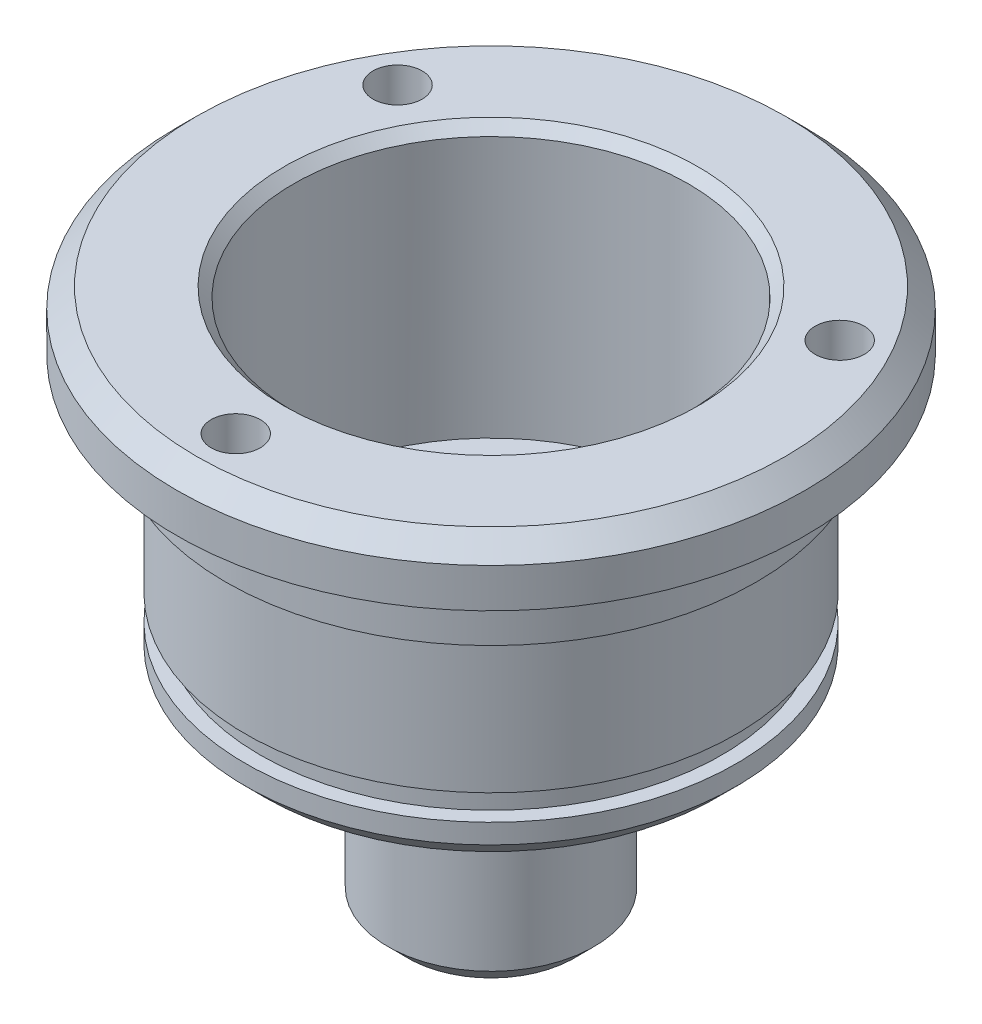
SolidWorks part; units mm, degrees
ref_plane "前视基准面" through (0, 0, 0) normal (0, 0, 1) x (1, 0, 0)
ref_plane "上视基准面" through (0, 0, 0) normal (0, 1, 0) x (1, 0, 0)
ref_plane "右视基准面" through (0, 0, 0) normal (1, 0, 0) x (0, 0, -1)
sketch "草图1" plane through (0, 0, 0) normal (0, 0, 1) x (1, 0, 0)
  line L0 (0, 0) -> (0, 17.0132) construction
  line L1 (12.5, 0) -> (10.05, 0)
  line L2 (12.5, 0) -> (12.5, 2)
  line L3 (12.5, 2) -> (11.75, 2)
  line L4 (11.75, 2) -> (11.75, 3.3)
  line L5 (11.75, 3.3) -> (12.5, 3.3)
  line L6 (12.5, 3.3) -> (12.5, 10.5)
  line L7 (12.5, 10.5) -> (13.5, 10.5)
  line L8 (16, 13.8) -> (16, 16.8)
  line L9 (16, 16.8) -> (10.05, 16.8)
  line L10 (10.05, 0) -> (10.05, 16.8)
  line L11 (13.5, 10.5) -> (13.5, 13.8)
  line L12 (13.5, 13.8) -> (16, 13.8)
  point P12 (12.5, 6.9)
  dimension "D1" = 7.2
  dimension "D2" = 23.5
  dimension "D3" = 25
  dimension "D4" = 1.3
  dimension "D5" = 20.1
  dimension "D6" = 2
  dimension "D7" = 27
  dimension "D8" = 10.5
  dimension "D9" = 32
  dimension "D10" = 3
revolve "旋转1" add sketch "草图1" angle 360 about L0
chamfer "倒角1" distance 1 angle 45 1 edges at (0, 0, -12.5)
chamfer "倒角2" distance 1 angle 45 1 edges at (0, 16.8, -16)
sketch "草图2" plane through (0, 13.8, 0) normal (0, -1, 0) x (-1, 0, 0)
  line L1 (-11.2583, 6.5) -> (0, -13) construction
  line L2 (0, -13) -> (11.2583, 6.5) construction
  line L3 (11.2583, 6.5) -> (-11.2583, 6.5) construction
  circle A0 centre (0, 0) radius 13
  circle A3 centre (0, 0) radius 6.5 construction
  circle A4 centre (-11.2583, 6.5) radius 1.45 construction
  circle A5 centre (11.2583, 6.5) radius 1.45 construction
  circle A6 centre (0, -13) radius 1.45 construction
  dimension "D1" = 26
  dimension "D2" = 2.9
sketch "草图3" plane through (0, 16.8, 0) normal (0, 1, 0) x (1, 0, 0)
  point P0 (-11.2583, 6.5)
  point P1 (11.2583, 6.5)
  point P3 (0, -13)
hole_wizard "M3 螺纹孔2" positions "3D草图2" profile "草图5" tap size "M3" standard "GB"
sketch3d "3D草图2"
  point P0 (11.2583, 16.8, -6.5)
  point P3 (-11.2583, 16.8, -6.5)
  point P6 (0, 16.8, 13)
sketch "草图5" plane through (11.2583, 16.8, -6.5) normal (1, 0, 0) x (0, 0, 1)
  line L0 (0, 0) -> (0, 4.7511)
  line L1 (0, 4.7511) -> (1.25, 4)
  line L2 (1.25, 4) -> (1.25, 0)
  line L5 (1.25, 0) -> (0, 0)
  line L10 (0, 4.7511) -> (-1.25, 4) construction
  line L11 (0, -6.35) -> (0, 107.95) construction
  dimension "螺纹孔钻头直径" = 2.5
  dimension "螺纹孔钻头深度" = 4
  dimension "导头角度" = 118
sketch "草图6" plane through (0, 0, 0) normal (0, 0, 1) x (1, 0, 0)
  line L0 (-11.5, 0) -> (11.5, 0) construction
  line L1 (-5.25, 0) -> (0, 0)
  line L2 (-5.25, -10.7) -> (0, -10.7)
  line L3 (0, 0) -> (0, -10.7)
  line L5 (-5.25, 0) -> (-5.25, -10.7)
  line L6 (0, 0) -> (0, -11.5619) construction
  dimension "D2" = 10.7
  dimension "D3" = 10.5
revolve "旋转2" add sketch "草图6" angle 360 about L6
sketch "草图7" plane through (0, 0, 0) normal (0, -1, 0) x (1, 0, 0)
  circle A2 centre (0, 0) radius 10.05 construction
  circle A4 centre (0, 0) radius 10.05
  circle A6 centre (0, 0) radius 1.75
  dimension "D1" = 3.5
extrude "凸台-拉伸1" add sketch "草图7" against normal blind 3
chamfer "倒角3" distance 1 angle 45 1 edges at (0, 3, -1.75)
chamfer "倒角4" distance 1 angle 45 1 edges at (0, -10.7, 5.25)
fillet "圆角1" radius 0.2 1 edges at (0, 0, -5.25)
sketch "草图8" plane through (0, -10.7, 0) normal (0, -1, 0) x (1, 0, 0)
  circle A0 centre (0, 0) radius 1.75
  dimension "D1" = 3.5
extrude "切除-拉伸1" cut sketch "草图8" against normal blind 77
hole_wizard "M5 螺纹孔1" positions "3D草图4" profile "草图10" tap size "M5" standard "GB"
sketch3d "3D草图4"
  point P0 (0, -10.7, 0)
sketch "草图10" plane through (0, -10.7, 0) normal (1, 0, 0) x (0, 0, -1)
  line L0 (0, 0) -> (0, 27.5)
  line L1 (0, 27.5) -> (2.1, 27.5)
  line L2 (2.1, 27.5) -> (2.1, 0)
  line L5 (2.1, 0) -> (0, 0)
  line L11 (0, -6.35) -> (0, 107.95) construction
  dimension "通孔螺纹孔钻头直径" = 4.2
  dimension "通孔螺纹孔钻头深度" = 27.5
sketch "草图12" plane through (0, 0, 0) normal (0, 0, 1) x (1, 0, 0)
  line L0 (0, -10.7) -> (0, 0) construction
  line L1 (-1.75, -10.7) -> (1.75, -10.7) construction
  line L2 (-4.25, -10.7) -> (4.25, -10.7) construction
  circle A0 centre (0, -7.7) radius 1.5
  dimension "D1" = 3
  dimension "D2" = 3
extrude "切除-拉伸2" cut sketch "草图12" against normal blind 77
chamfer "倒角5" distance 0.5 angle 45 1 edges at (0, 16.8, -10.05)
